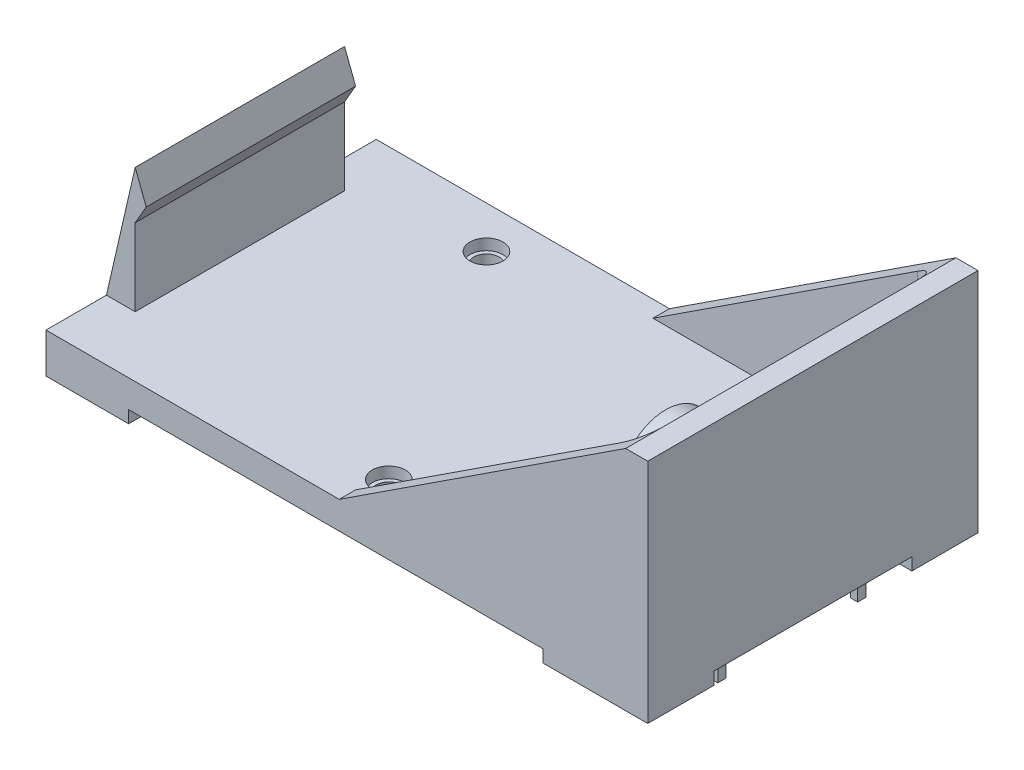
SolidWorks part; units mm, degrees
ref_plane "Спереди" through (0, 0, 0) normal (0, 0, 1) x (1, 0, 0)
ref_plane "Сверху" through (0, 0, 0) normal (0, 1, 0) x (1, 0, 0)
ref_plane "Справа" through (0, 0, 0) normal (1, 0, 0) x (0, 0, -1)
sketch "Эскиз1" plane through (0, 0, 0) normal (0, 1, 0) x (1, 0, 0)
  line L1 (-27.305, 14.985) -> (27.305, 14.985)
  line L2 (-27.305, 14.985) -> (-27.305, -14.985)
  line L3 (-27.305, -14.985) -> (27.305, -14.985)
  line L4 (27.305, 14.985) -> (27.305, -14.985)
  line L5 (-27.305, 14.985) -> (27.305, -14.985) construction
  line L6 (-27.305, -14.985) -> (27.305, 14.985) construction
  point P0 (0, 0)
  dimension "D1" = 29.97
  dimension "D2" = 54.61
extrude "Бобышка-Вытянуть1" add sketch "Эскиз1" along normal blind 2.5
sketch "Эскиз2" plane through (0, 2.5, 0) normal (0, 1, 0) x (1, 0, 0)
  line L0 (27.305, -14.985) -> (-0.695, -14.985)
  line L1 (-27.305, -14.985) -> (27.305, -14.985) construction
  line L2 (-0.695, -14.985) -> (-0.695, -13.485)
  line L3 (-0.695, -13.485) -> (23.305, -13.485)
  line L4 (25.305, -11.485) -> (25.305, 11.485)
  line L5 (27.305, -14.985) -> (27.305, 14.985)
  line L6 (27.305, -14.985) -> (27.305, 14.985) construction
  line L7 (34.4496, 0) -> (-14.6404, 0) construction
  line L8 (27.305, 14.985) -> (-0.695, 14.985)
  line L9 (-0.695, 14.985) -> (-0.695, 13.485)
  line L10 (-0.695, 13.485) -> (23.305, 13.485)
  arc A0 (25.305, -11.485) -> (23.305, -13.485) centre (23.305, -11.485) cw
  arc A1 (25.305, 11.485) -> (23.305, 13.485) centre (23.305, 11.485) ccw
  point P17 (27.305, 0)
  point P22 (25.305, 0)
  dimension "D4" = 2
  dimension "D1" = 1.5
  dimension "D2" = 2
  dimension "D3" = 28
extrude "Бобышка-Вытянуть2" add sketch "Эскиз2" along normal blind 17
sketch "Эскиз3" plane through (0, 0, 14.985) normal (0, 0, 1) x (1, 0, 0)
  line L0 (-0.695, 2.5) -> (25.305, 19.5)
  line L1 (-0.695, 19.5) -> (27.305, 19.5) construction
  line L2 (25.305, 19.5) -> (-0.695, 19.5)
  line L3 (-0.695, 19.5) -> (-0.695, 2.5)
extrude "Вырез-Вытянуть1" cut sketch "Эскиз3" against normal through all
sketch "Эскиз4" plane through (0, 2.5, 0) normal (0, 1, 0) x (1, 0, 0)
  line L0 (0, 0) -> (36.3439, 0) construction
  line L1 (-34.9908, 11.175) -> (34.2331, 11.175) construction
  line L2 (-15.0193, -11.175) -> (34.2331, -11.175) construction
  line L3 (27.305, -14.985) -> (27.305, 14.985) construction
  circle A0 centre (-13.495, 11.175) radius 1.145
  circle A1 centre (-0.005, -11.175) radius 1.145
  circle A2 centre (13.475, 11.175) radius 1.145
  dimension "D1" = 2.29
  dimension "D2" = 22.35
  dimension "D3" = 27.31
  dimension "D4" = 13.49
  dimension "D5" = 26.97
extrude "Вырез-Вытянуть2" cut sketch "Эскиз4" against normal through all
sketch "Эскиз5" plane through (0, 0, 0) normal (0, -1, 0) x (1, 0, 0)
  line L1 (-27.305, 14.985) -> (-19.805, 14.985)
  line L2 (-27.305, 14.985) -> (-27.305, 8.985)
  line L3 (-27.305, 8.985) -> (-19.805, 8.985)
  line L4 (-19.805, 14.985) -> (-19.805, 8.985)
  line L5 (27.305, 14.985) -> (17.805, 14.985)
  line L6 (27.305, 14.985) -> (27.305, 8.985)
  line L7 (27.305, 8.985) -> (17.805, 8.985)
  line L8 (17.805, 14.985) -> (17.805, 8.985)
  line L9 (27.305, -14.985) -> (17.805, -14.985)
  line L10 (27.305, -14.985) -> (27.305, -8.985)
  line L11 (27.305, -8.985) -> (17.805, -8.985)
  line L12 (17.805, -14.985) -> (17.805, -8.985)
  line L13 (-27.305, -14.985) -> (-19.805, -14.985)
  line L14 (-27.305, -14.985) -> (-27.305, -8.985)
  line L15 (-27.305, -8.985) -> (-19.805, -8.985)
  line L16 (-19.805, -14.985) -> (-19.805, -8.985)
  circle A0 centre (-0.005, 11.175) radius 2.25
  circle A1 centre (13.475, -11.175) radius 2.25
  circle A2 centre (-13.495, -11.175) radius 2.25
  dimension "D1" = 4.5
  dimension "D2" = 6
  dimension "D3" = 9.5
  dimension "D4" = 7.5
extrude "Бобышка-Вытянуть3" add sketch "Эскиз5" along direction (0, -1, 0) on the side of the normal offset from surface (1.12 mm away) 20.62
sketch "Эскиз6" plane through (0, 2.5, 0) normal (0, 1, 0) x (1, 0, 0)
  circle A15 centre (-13.495, 11.175) radius 1.145
  circle A16 centre (-13.495, 11.175) radius 1.145
  circle A18 centre (13.475, 11.175) radius 1.145
  circle A19 centre (13.475, 11.175) radius 1.145
  circle A21 centre (-0.005, -11.175) radius 1.145
  circle A22 centre (-0.005, -11.175) radius 1.145
  dimension "D1" = 0
  dimension "D2" = 0
  dimension "D3" = 0
extrude "Вырез-Вытянуть3" cut sketch "Эскиз6" against normal through all
sketch "Эскиз7" plane through (0, 2.5, 0) normal (0, 1, 0) x (1, 0, 0)
  circle A0 centre (-13.495, 11.175) radius 1.5
  circle A1 centre (13.475, 11.175) radius 1.5
  circle A2 centre (-0.005, -11.175) radius 1.5
  dimension "D1" = 3
extrude "Вырез-Вытянуть4" cut sketch "Эскиз7" against normal blind 1
sketch "Эскиз8" plane through (0, 0, 0) normal (0, 0, 1) x (1, 0, 0)
  line L0 (-27.305, 2.5) -> (-24.695, 13.85)
  line L1 (-24.695, 13.85) -> (-23.695, 11.2321)
  line L2 (-23.695, 11.2321) -> (-24.695, 9.5)
  line L3 (-24.695, 9.5) -> (-24.695, 2.5)
  line L4 (-27.305, 2.5) -> (-0.695, 2.5) construction
  line L5 (-24.695, 2.5) -> (-27.305, 2.5)
  line L6 (-27.305, -1.12) -> (-19.805, -1.12) construction
  dimension "D1" = 14.97
  dimension "D2" = 49
  dimension "D3" = 7
  dimension "D4" = 1
  dimension "D5" = 2
extrude "Бобышка-Вытянуть4" add sketch "Эскиз8" along normal blind 9.5 and the other way blind 9.5
sketch "Эскиз9" plane through (0, 0, 0) normal (0, -1, 0) x (1, 0, 0)
  line L0 (25.075, 20.363) -> (25.075, -22.124) construction
  line L1 (36.5427, 0) -> (8.3422, 0) construction
  line L2 (24.745, 5.97) -> (25.405, 5.97)
  line L3 (24.745, -6.73) -> (25.405, -6.73)
  line L4 (24.745, -6.73) -> (24.745, -5.97)
  line L5 (24.745, -5.97) -> (25.405, -5.97)
  line L6 (25.405, -6.73) -> (25.405, -5.97)
  line L7 (24.745, -6.73) -> (25.405, -5.97) construction
  line L8 (24.745, -5.97) -> (25.405, -6.73) construction
  line L9 (25.405, 6.73) -> (25.405, 5.97)
  line L10 (24.745, 6.73) -> (25.405, 6.73)
  line L11 (24.745, 6.73) -> (24.745, 5.97)
  circle A0 centre (13.475, -11.175) radius 1.145 construction
  point P4 (25.075, -6.35)
  point P11 (0, 0)
  dimension "D4" = 11.6
  dimension "D1" = 0.76
  dimension "D2" = 0.66
  dimension "D3" = 12.7
extrude "Бобышка-Вытянуть5" add sketch "Эскиз9" along normal blind 3
sketch "Эскиз10" plane through (25.305, 0, 0) normal (-1, 0, 0) x (0, 0, 1)
  line L0 (-18.4903, 11.48) -> (20.51, 11.48) construction
  line L1 (0, 0) -> (0, 20.3244) construction
  line L2 (-14.985, -1.12) -> (-8.985, -1.12) construction
  circle A0 centre (-6.35, 11.48) radius 3.75
  circle A1 centre (6.35, 11.48) radius 3.75
  dimension "D3" = 7.5
  dimension "D1" = 12.6
  dimension "D2" = 12.7
extrude "Бобышка-Вытянуть6" add sketch "Эскиз10" along normal blind 1
sketch "Эскиз11" plane through (24.305, 0, 0) normal (-1, 0, 0) x (0, 0, 1)
  circle A0 centre (-6.35, 11.48) radius 3
  circle A1 centre (-6.35, 11.48) radius 2
  dimension "D1" = 6
  dimension "D2" = 4
extrude "Бобышка-Вытянуть7" add sketch "Эскиз11" along normal blind 4
sketch "Эскиз12" plane through (24.305, 0, 0) normal (-1, 0, 0) x (0, 0, 1)
  circle A0 centre (6.35, 11.48) radius 4.25
  circle A1 centre (6.35, 11.48) radius 3.25
  dimension "D1" = 8.5
  dimension "D2" = 6.5
extrude "Бобышка-Вытянуть8" add sketch "Эскиз12" along normal blind 4
